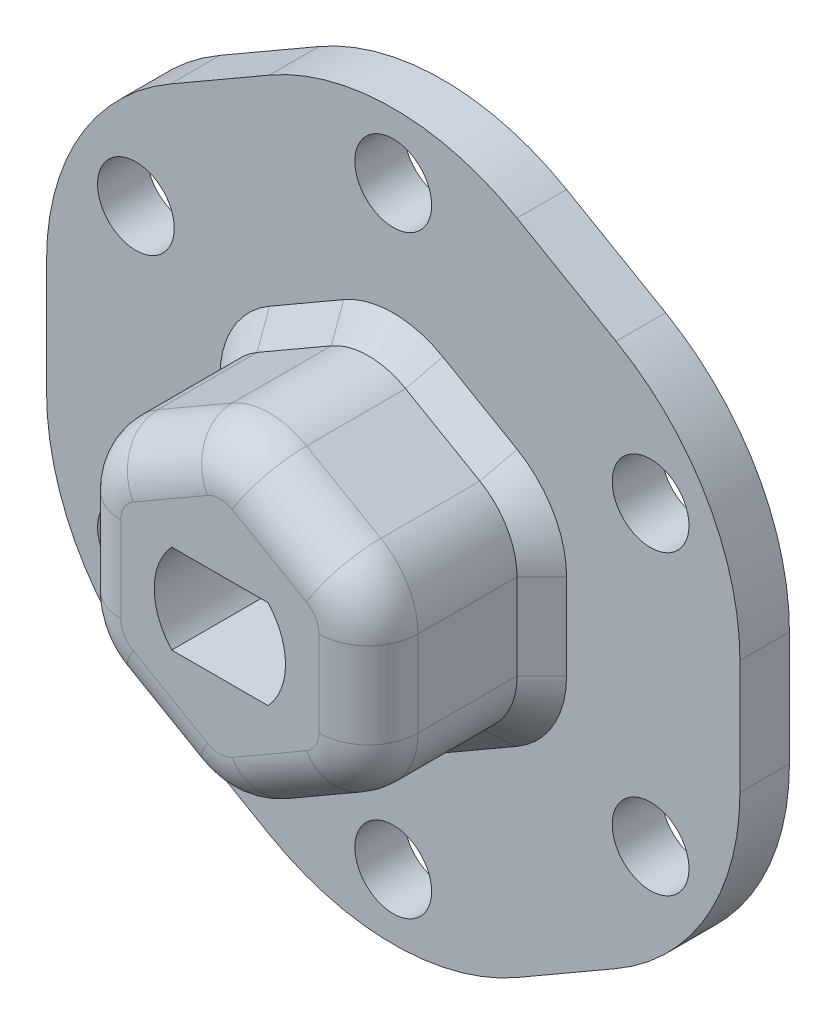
SolidWorks part; units mm, degrees
ref_plane "Front Plane" through (0, 0, 0) normal (0, 0, 1) x (1, 0, 0)
ref_plane "Top Plane" through (0, 0, 0) normal (0, 1, 0) x (1, 0, 0)
ref_plane "Right Plane" through (0, 0, 0) normal (1, 0, 0) x (0, 0, -1)
sketch "Sketch1" plane through (0, 0, 0) normal (0, 0, 1) x (1, 0, 0)
  line L1 (-5, 13.2791) -> (-9, 10.9697)
  line L2 (-14, 2.3094) -> (-14, -2.3094)
  line L3 (-9, -10.9697) -> (-5, -13.2791)
  line L4 (5, -13.2791) -> (9, -10.9697)
  line L5 (14, -2.3094) -> (14, 2.3094)
  line L6 (9, 10.9697) -> (5, 13.2791)
  circle A0 centre (0, 0) radius 14 construction
  circle A1 centre (0, 0) radius 12 construction
  circle A2 centre (0, 12) radius 1.55
  circle A3 centre (10.3923, 6) radius 1.55
  circle A4 centre (10.3923, -6) radius 1.55
  circle A5 centre (0, -12) radius 1.55
  circle A6 centre (-10.3923, -6) radius 1.55
  circle A7 centre (-10.3923, 6) radius 1.55
  arc A8 (14, 2.3094) -> (9, 10.9697) centre (4, 2.3094) ccw
  arc A9 (9, -10.9697) -> (14, -2.3094) centre (4, -2.3094) ccw
  arc A10 (-5, -13.2791) -> (5, -13.2791) centre (0, -4.6188) ccw
  arc A11 (-14, -2.3094) -> (-9, -10.9697) centre (-4, -2.3094) ccw
  arc A12 (-9, 10.9697) -> (-14, 2.3094) centre (-4, 2.3094) ccw
  arc A13 (-5, 13.2791) -> (5, 13.2791) centre (0, 4.6188) cw
  point P27 (0, 0)
  dimension "D1" = 6
  dimension "D2" = 10
extrude "Boss-Extrude1" add sketch "Sketch1" along normal blind 2
sketch "Sketch3" plane through (0, 0, 2) normal (0, 0, 1) x (1, 0, 0)
  line L1 (-1.5, 6.0622) -> (-4.5, 4.3301)
  line L2 (-6, 1.7321) -> (-6, -1.7321)
  line L3 (-4.5, -4.3301) -> (-1.5, -6.0622)
  line L4 (1.5, -6.0622) -> (4.5, -4.3301)
  line L5 (6, -1.7321) -> (6, 1.7321)
  line L6 (4.5, 4.3301) -> (1.5, 6.0622)
  line L7 (1.9449, -1.8) -> (-1.9449, -1.8)
  line L9 (1.9449, 1.8) -> (-1.9449, 1.8)
  line L11 (2.3942, -1.1359) -> (-2.3942, 1.1359) construction
  line L12 (2.3942, 1.1359) -> (-2.3942, -1.1359) construction
  circle A0 centre (0, 0) radius 6 construction
  arc A1 (-1.9449, 1.8) -> (-1.9449, -1.8) centre (0, 0) ccw
  arc A2 (1.9449, -1.8) -> (1.9449, 1.8) centre (0, 0) ccw
  arc A3 (6, 1.7321) -> (4.5, 4.3301) centre (3, 1.7321) ccw
  arc A4 (4.5, -4.3301) -> (6, -1.7321) centre (3, -1.7321) ccw
  arc A5 (-1.5, -6.0622) -> (1.5, -6.0622) centre (0, -3.4641) ccw
  arc A6 (-6, -1.7321) -> (-4.5, -4.3301) centre (-3, -1.7321) ccw
  arc A7 (-4.5, 4.3301) -> (-6, 1.7321) centre (-3, 1.7321) ccw
  arc A8 (-1.5, 6.0622) -> (1.5, 6.0622) centre (0, 3.4641) cw
  dimension "D1" = 3
extrude "Boss-Extrude4" add sketch "Sketch3" along normal blind 7
chamfer "Chamfer2" distance 1 angle 45 12 edges at (3, 5.1962, 2) (6, 0, 2) (3, -5.1962, 2) (-3, -5.1962, 2) (-6, 0, 2) (-3, 5.1962, 2) (5.5981, -3.2321, 2) (0, -6.4641, 2) (5.5981, 3.2321, 2) (-5.5981, -3.2321, 2) (0, 6.4641, 2) (-5.5981, 3.2321, 2)
fillet "Fillet1" radius 2 12 edges at (5.5981, -3.2321, 9) (3, -5.1962, 9) (0, -6.4641, 9) (-3, -5.1962, 9) (-5.5981, -3.2321, 9) (-6, 0, 9) (-5.5981, 3.2321, 9) (-3, 5.1962, 9) (0, 6.4641, 9) (3, 5.1962, 9) (5.5981, 3.2321, 9) (6, 0, 9)
